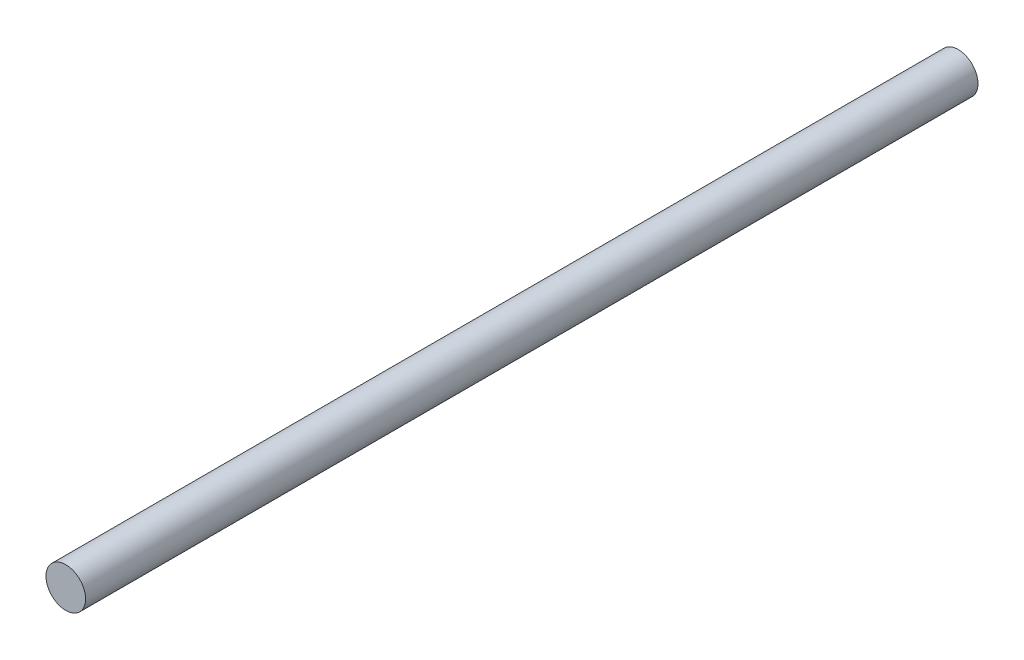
SolidWorks part; units mm, degrees
ref_plane "Front Plane" through (0, 0, 0) normal (0, 0, 1) x (1, 0, 0)
ref_plane "Top Plane" through (0, 0, 0) normal (0, 1, 0) x (1, 0, 0)
ref_plane "Right Plane" through (0, 0, 0) normal (1, 0, 0) x (0, 0, -1)
sketch "Sketch1" plane through (0, 0, 0) normal (0, 0, 1) x (1, 0, 0)
  circle A0 centre (0, 0) radius 30
  dimension "D1" = 60
extrude "Boss-Extrude1" add sketch "Sketch1" against normal blind 1350
